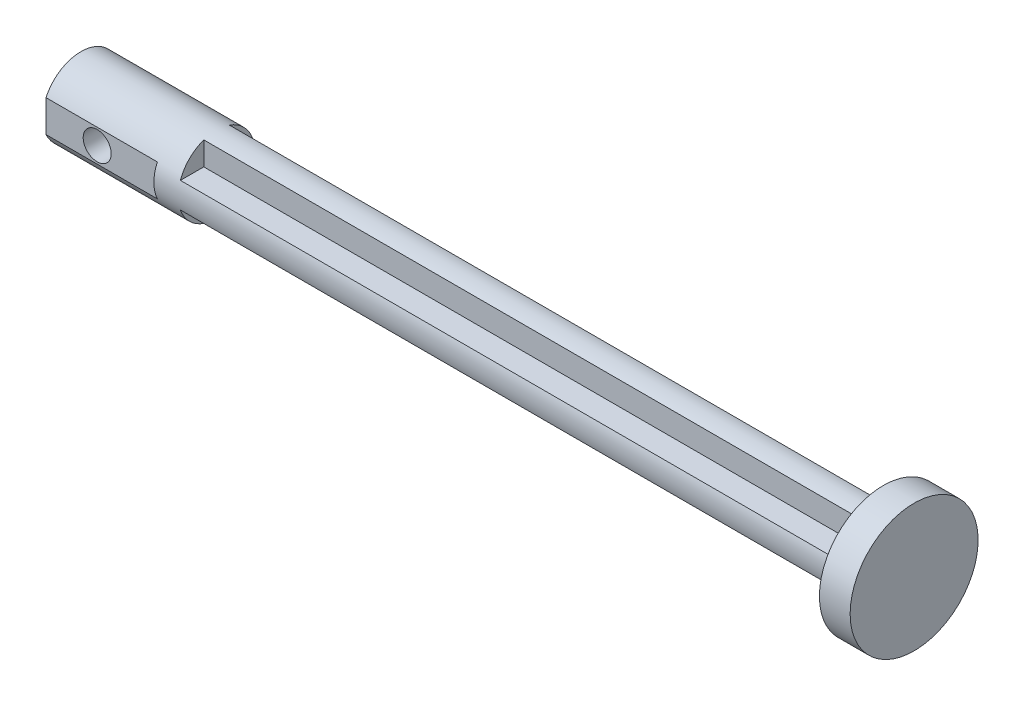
SolidWorks part; units mm, degrees
ref_plane "Front" through (0, 0, 0) normal (0, 0, 1) x (1, 0, 0)
ref_plane "Top" through (0, 0, 0) normal (0, 1, 0) x (1, 0, 0)
ref_plane "Right" through (0, 0, 0) normal (1, 0, 0) x (0, 0, -1)
sketch "Sketch1" plane through (0, 0, 0) normal (1, 0, 0) x (0, 0, -1)
  circle A0 centre (0, 0) radius 3.81
  dimension "D1" = 7.62
extrude "Base-Extrude" add sketch "Sketch1" along normal blind 13.462
ref_plane "Plane5" through (79.629, 0, 0) normal (1, 0, 0) x (0, 0, -1)
sketch "Sketch2" plane through (13.462, 0, 0) normal (1, 0, 0) x (0, 0, -1)
  line L0 (1.27, -1.27) -> (-1.27, 1.27) construction
  line L1 (1.27, -3.5921) -> (1.27, -1.27)
  line L2 (1.27, 1.27) -> (-1.27, -1.27) construction
  line L3 (-1.27, 3.5921) -> (-1.27, 1.27)
  line L4 (3.5921, 1.27) -> (1.27, 1.27)
  line L6 (-3.5921, -1.27) -> (-1.27, -1.27)
  line L8 (-1.27, 1.27) -> (-3.5921, 1.27)
  line L9 (1.27, 1.27) -> (1.27, 3.5921)
  line L10 (-1.27, -1.27) -> (-1.27, -3.5921)
  line L11 (1.27, -1.27) -> (3.5921, -1.27)
  circle A0 centre (0, 0) radius 3.81 construction
  arc A1 (1.27, 3.5921) -> (-1.27, 3.5921) centre (0, 0) ccw
  arc A2 (-3.5921, 1.27) -> (-3.5921, -1.27) centre (0, 0) ccw
  arc A3 (-1.27, -3.5921) -> (1.27, -3.5921) centre (0, 0) ccw
  arc A4 (3.5921, -1.27) -> (3.5921, 1.27) centre (0, 0) ccw
  dimension "D1" = 2.54
extrude "Boss-Extrude4" add sketch "Sketch2" along normal up to surface (66.167 mm away)
sketch "Sketch3" plane through (79.629, 0, 0) normal (1, 0, 0) x (0, 0, -1)
  circle A0 centre (0, 0) radius 6.35
  dimension "D1" = 12.7
extrude "Boss-Extrude5" add sketch "Sketch3" along normal blind 3.048
sketch "Sketch4" plane through (0, 0, 0) normal (-1, 0, 0) x (0, 0, 1)
  line L0 (3.4635, 1.5875) -> (3.4635, -1.5875)
  circle A1 centre (0, 0) radius 3.81
  arc A2 (3.4635, -1.5875) -> (3.4635, 1.5875) centre (0, 0) ccw
  dimension "D2" = 3.175
  dimension "D1" = 0
extrude "Cut-Extrude1" cut sketch "Sketch4" against normal blind 11.049
sketch "Sketch5" plane through (0, 0, 3.4635) normal (0, 0, 1) x (1, 0, 0)
  line L0 (0, 0) -> (5.08, 0) construction
  line L1 (0, 1.5875) -> (0, -1.5875) construction
  circle A0 centre (5.08, 0) radius 1.3891
  dimension "D1" = 5.08
  dimension "D2" = 2.7781
extrude "Cut-Extrude2" cut sketch "Sketch5" against normal blind 3.81
